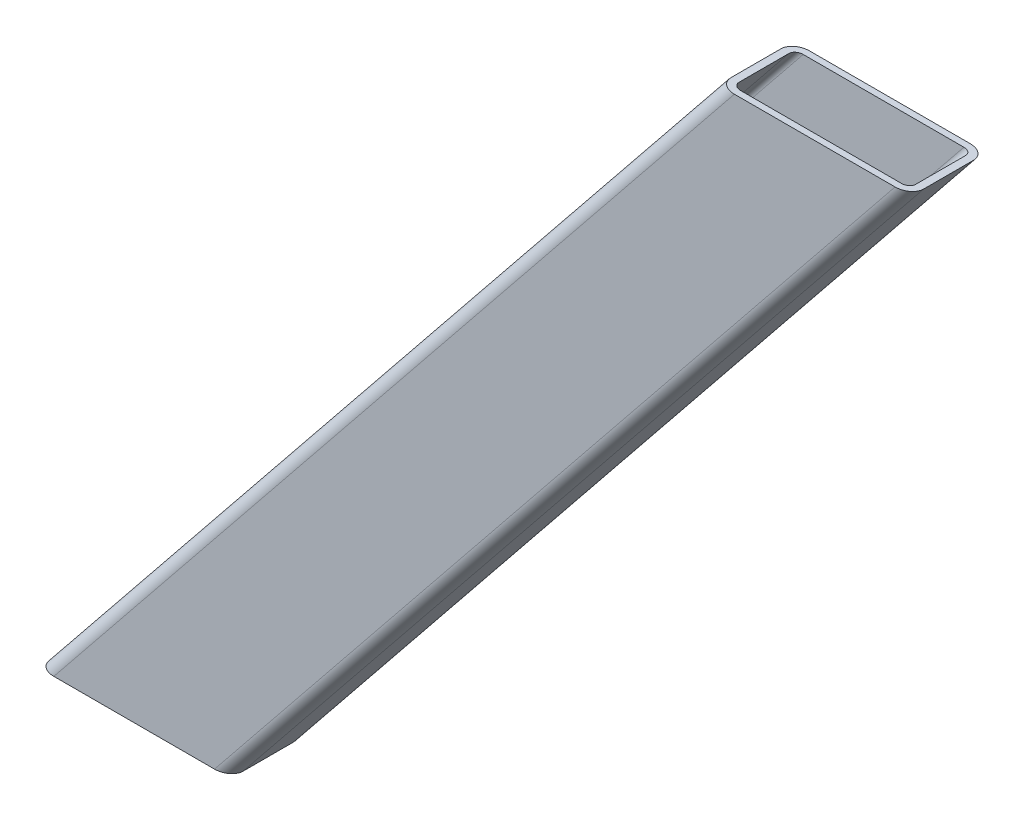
SolidWorks part; units mm, degrees
ref_plane "Front Plane" through (0, 0, 0) normal (0, 0, 1) x (1, 0, 0)
ref_plane "Top Plane" through (0, 0, 0) normal (0, 1, 0) x (1, 0, 0)
ref_plane "Right Plane" through (0, 0, 0) normal (1, 0, 0) x (0, 0, -1)
sketch "Sketch1" plane through (0, 0, 0) normal (0, 0, 1) x (1, 0, 0)
  line L0 (-62.1245, -382.6216) -> (-1443.8617, -2097.1216)
  line L1 (-1143.8617, -382.6216) -> (481.7383, -382.6216) construction
  line L2 (-1052.399, -2097.1216) -> (329.3383, -382.6216)
  dimension "D1" = 304.8
  dimension "D2" = 152.4
other "Structural Member1"
ref_plane "Plane1" through (56.5369, -478.2524, -76.2) normal (-0.6275, -0.7786, 0) x (0, 0, 1)
sketch "Sketch11" plane through (56.5369, -478.2524, -76.2) normal (-0.6275, -0.7786, 0) x (0, 0, 1)
  line L0 (-50.8, -139.7) -> (50.8, -139.7)
  line L1 (-63.5, -127) -> (-63.5, 127)
  line L2 (50.8, 139.7) -> (-50.8, 139.7)
  line L3 (63.5, 127) -> (63.5, -127)
  line L4 (-50.8, -152.4) -> (50.8, -152.4)
  line L5 (-76.2, -127) -> (-76.2, 127)
  line L6 (50.8, 152.4) -> (-50.8, 152.4)
  line L7 (76.2, 127) -> (76.2, -127)
  line L8 (0, 152.4) -> (0, 139.7) construction
  line L9 (0, 139.7) -> (0, -139.7) construction
  line L10 (0, -139.7) -> (0, -152.4) construction
  line L11 (-76.2, 0) -> (-63.5, 0) construction
  line L12 (-63.5, 0) -> (63.5, 0) construction
  line L13 (63.5, 0) -> (76.2, 0) construction
  arc A0 (76.2, 127) -> (50.8, 152.4) centre (50.8, 127) ccw
  arc A1 (50.8, -152.4) -> (76.2, -127) centre (50.8, -127) ccw
  arc A2 (-76.2, -127) -> (-50.8, -152.4) centre (-50.8, -127) ccw
  arc A3 (-50.8, 152.4) -> (-76.2, 127) centre (-50.8, 127) ccw
  arc A4 (-50.8, 139.7) -> (-63.5, 127) centre (-50.8, 127) ccw
  arc A5 (63.5, 127) -> (50.8, 139.7) centre (50.8, 127) ccw
  arc A6 (50.8, -139.7) -> (63.5, -127) centre (50.8, -127) ccw
  arc A7 (-63.5, -127) -> (-50.8, -139.7) centre (-50.8, -127) ccw
  point P6 (-76.2, 152.4)
  point P33 (76.2, 152.4)
  point P35 (-76.2, -152.4)
  point P36 (76.2, -152.4)
  point P37 (0, 0)
  dimension "D1" = 25.4
  dimension "Thickness" = 12.7
  dimension "V_leg" = 304.8
  dimension "H_leg" = 152.4
other "Trim/Extend1"
other "Trim/Extend2"
